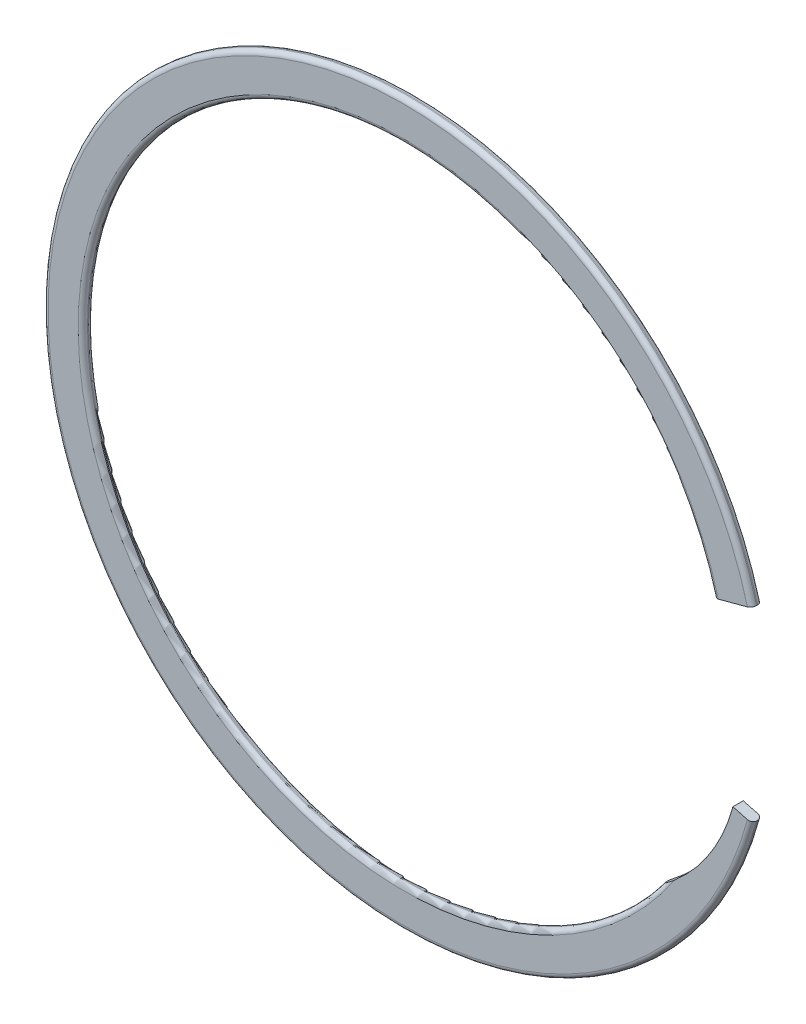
SolidWorks part; units mm, degrees
ref_plane "Front Plane" through (0, 0, 0) normal (0, 0, 1) x (1, 0, 0)
ref_plane "Top Plane" through (0, 0, 0) normal (0, 1, 0) x (1, 0, 0)
ref_plane "Right Plane" through (0, 0, 0) normal (1, 0, 0) x (0, 0, -1)
sketch "Sketch1" plane through (0, 0, 0) normal (0, 0, 1) x (1, 0, 0)
  line L0 (24.4094, 0) -> (27.4066, 0) construction
  line L1 (-24.4094, 0) -> (-27.4066, 0) construction
  line L2 (23.5777, 6.3176) -> (26.4727, 7.0934)
  line L3 (23.5777, -6.3176) -> (26.4727, -7.0934)
  line L4 (25.0252, -6.7055) -> (22.7117, -15.3394) construction
  line L5 (22.7117, -15.3394) -> (19.6265, -14.5127) construction
  circle A0 centre (0, 0) radius 24.4094
  circle A1 centre (0, 0) radius 27.4066
  arc A2 (25.0252, -6.7055) -> (19.6265, -14.5127) centre (11.4017, -3.0551) cw
  dimension "Free Diameter" = 48.8188
  dimension "Radial Wall" = 2.9972
  dimension "D3" = 30
sketch "Sketch2" plane through (0, 0, 0) normal (0, 0, 1) x (1, 0, 0)
  line L0 (23.5777, -6.3176) -> (26.4727, -7.0934) construction
  line L1 (23.5777, 6.3176) -> (26.4727, 7.0934) construction
  line L2 (25.0252, -6.7055) -> (26.4727, -7.0934)
  line L3 (23.5777, 6.3176) -> (26.4727, 7.0934)
  circle A0 centre (0, 0) radius 27.4066 construction
  arc A1 (19.6265, -14.5127) -> (25.0252, -6.7055) centre (11.4017, -3.0551) ccw construction
  circle A2 centre (0, 0) radius 24.4094 construction
  arc A3 (26.4727, 7.0934) -> (26.4727, -7.0934) centre (0, 0) ccw
  arc A4 (19.6265, -14.5127) -> (25.0252, -6.7055) centre (11.4017, -3.0551) ccw
  arc A5 (23.5777, 6.3176) -> (19.6265, -14.5127) centre (0, 0) ccw
  arc A6 (23.5777, 6.3176) -> (19.6265, -14.5127) centre (0, 0) cw construction
  arc A7 (26.4727, 7.0934) -> (26.4727, -7.0934) centre (0, 0) cw construction
extrude "Extrude1" add sketch "Sketch2" along normal mid plane 0.7874
fillet "Fillet1" radius 0.3543 4 edges at (-27.4066, 0, -0.3937) (-27.4066, 0, 0.3937) (-23.9818, 4.549, -0.3937) (-23.9818, 4.549, 0.3937)
sketch "Sketch3" plane through (0, 0, 0) normal (1, 0, 0) x (0, 0, -1)
  line L0 (-0.4953, 25.4) -> (-0.4953, 24.6761)
  line L1 (-0.4953, 24.6761) -> (0.4953, 24.6761)
  line L2 (0.4953, 24.6761) -> (0.4953, 25.4)
  line L3 (0.4953, 25.4) -> (66.675, 25.4)
  line L4 (66.675, 25.4) -> (66.675, 0)
  line L5 (-0.4953, 25.4) -> (-5.715, 25.4)
  line L6 (-5.715, 25.4) -> (-9.525, 21.59)
  line L7 (-9.525, 21.59) -> (-9.525, 0)
  line L8 (-9.525, 0) -> (66.675, 0)
  line L9 (-9.525, 0) -> (66.675, 0) construction
  line L10 (0, 0) -> (0, 24.6761) construction
  dimension "D1" = 45
  dimension "Groove width" = 0.9906
  dimension "groove dia" = 49.3522
  dimension "shaft dia" = 50.8
  dimension "D2" = 43.18
  dimension "D3" = 76.2
  dimension "D4" = 9.525
revolve "Revolve1" [suppressed] add sketch "Sketch3" angle 360 about L8
equation "\"D1@Fillet1\" = (\"Ring Thickness@Extrude1\"*.9)/2"
equation "\"D2@Sketch3\" = \"shaft dia@Sketch3\"*.85"
equation "\"D4@Sketch3\" = \"D3@Sketch3\"/8"
equation "\"D3@Sketch3\" = \"shaft dia@Sketch3\"*1.50"
